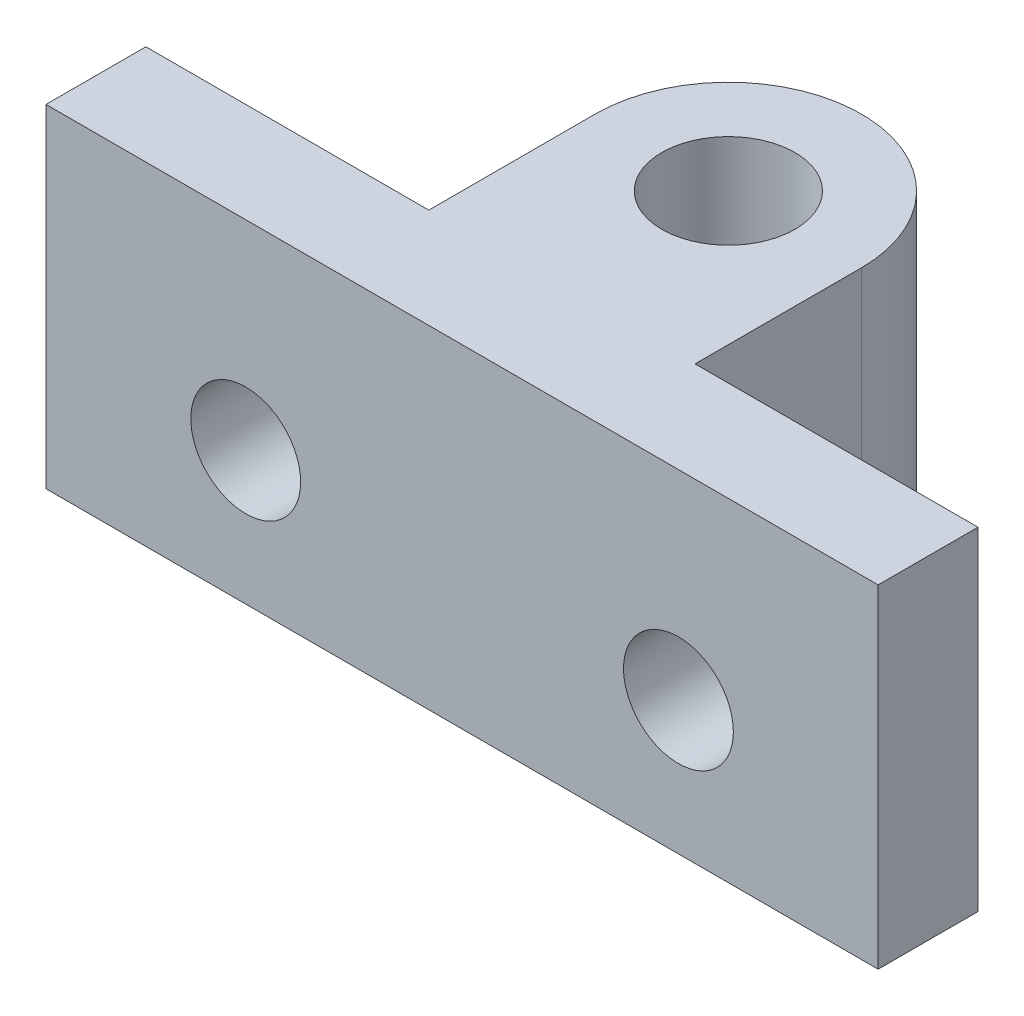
SolidWorks part; units mm, degrees
ref_plane "Front" through (0, 0, 0) normal (0, 0, 1) x (1, 0, 0)
ref_plane "Top" through (0, 0, 0) normal (0, 1, 0) x (1, 0, 0)
ref_plane "Right" through (0, 0, 0) normal (1, 0, 0) x (0, 0, -1)
sketch "草图2" plane through (0, 0, 0) normal (0, 1, 0) x (1, 0, 0)
  line L0 (8.5, 8) -> (8.5, 3)
  line L1 (0, 0) -> (25, 0)
  line L2 (0, 0) -> (0, 3)
  line L3 (0, 3) -> (25, 3)
  line L4 (25, 0) -> (25, 3)
  line L5 (16.5, 8) -> (16.5, 3)
  circle A0 centre (12.5, 8) radius 4
  circle A1 centre (12.5, 8) radius 2
  dimension "D2" = 8
  dimension "D6" = 4
  dimension "D1" = 3
  dimension "D3" = 5
  dimension "D4" = 25
  dimension "D5" = 12.5
extrude "凸台-拉伸1" add sketch "草图2" along normal blind 10 contours A0 A1 | A0 L3 L5 | A0 L0 L3 | L1 L4 L3 L2
hole_wizard "Ø3.3 (3.3) 直径孔1" positions "草图3" profile "草图4" hole size "Ø3.3" standard "GB"
sketch "草图3" plane through (0, 0, 0) normal (0, 0, 1) x (1, 0, 0)
  point P0 (6, 4)
  point P3 (19, 4)
sketch "草图4" plane through (6, 4, 0) normal (1, 0, 0) x (0, -1, 0)
  line L0 (0, 0) -> (0, 12)
  line L1 (0, 12) -> (1.65, 12)
  line L2 (1.65, 12) -> (1.65, 0)
  line L5 (1.65, 0) -> (0, 0)
  line L11 (0, -6.35) -> (0, 107.95) construction
  dimension "通孔孔直径" = 3.3
  dimension "通孔孔深度" = 12
